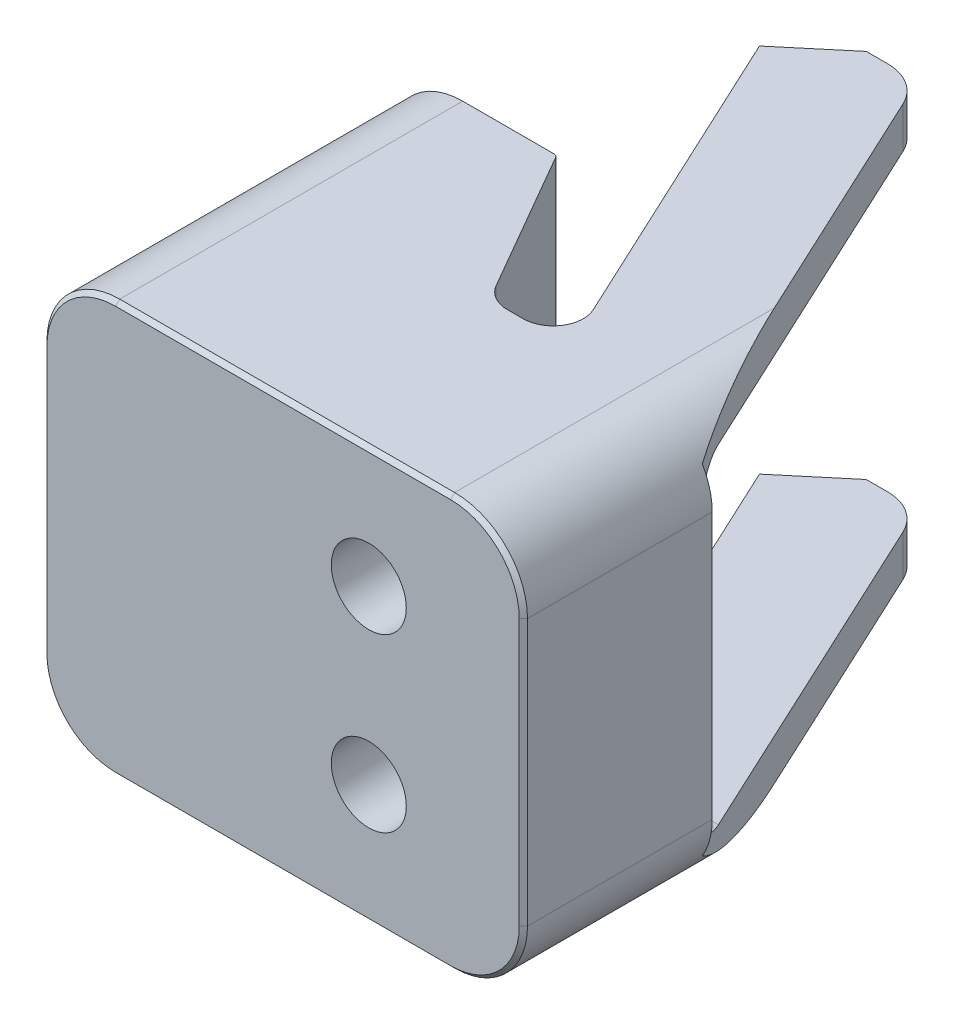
SolidWorks part; units mm, degrees
ref_plane "Front Plane" through (0, 0, 0) normal (0, 0, 1) x (1, 0, 0)
ref_plane "Top Plane" through (0, 0, 0) normal (0, 1, 0) x (1, 0, 0)
ref_plane "Right Plane" through (0, 0, 0) normal (1, 0, 0) x (0, 0, -1)
ref_plane "Plane1" through (0, -15.875, 0) normal (0, 1, 0) x (-1, 0, 0)
sketch "Sketch1" plane through (0, 0, 0) normal (1, 0, 0) x (0, 0, -1)
  line L0 (0, 41.896) -> (0, -41.896) construction
  line L1 (0, 38.0873) -> (109.474, 38.0873)
  line L2 (109.474, 38.0873) -> (109.474, -38.0873)
  line L3 (109.474, -38.0873) -> (0, -38.0873)
  line L4 (0, -38.0873) -> (0, 38.0873)
  line L6 (58.8563, 0) -> (-58.8563, 0) construction
  dimension "D1" = 76.1746
  dimension "D2" = 109.474
  dimension "D3" = 38.0873
extrude "Extrude1" add sketch "Sketch1" against normal blind 88.8746
sketch "Sketch2" plane through (0, 0, 0) normal (0, 1, 0) x (1, 0, 0)
  line L0 (0, 34.925) -> (-1.8244, 34.925)
  line L1 (0, 0) -> (0, 109.474) construction
  line L2 (-1.8244, 34.925) -> (-49.2012, 136.525)
  line L3 (-49.2012, 136.525) -> (0, 136.525)
  line L4 (0, -41.896) -> (0, 41.896) construction
  line L5 (0, 136.525) -> (0, 34.925)
  line L6 (-88.8746, 0) -> (0, 0) construction
  line L8 (-12.6746, 10.56) -> (-12.6746, -9.1288) construction
  line L9 (-88.8746, 0) -> (-88.8746, 109.474) construction
  line L10 (-1.8244, 34.925) -> (19.3938, -10.5776) construction
  circle A0 centre (-2.1145, 10.5601) radius 10.5601 construction
  dimension "D5" = 21.1201
  dimension "D6" = 76.2
  dimension "D2" = 34.925
  dimension "D3" = 25
  dimension "D4" = 101.6
extrude "Cut-Extrude1" cut sketch "Sketch2" against normal mid plane 127
fillet "Fillet2" radius 13.462 4 edges at (-88.8746, 38.0873, -54.737) (-88.8746, -38.0873, -54.737) (0, 38.0873, -17.4625) (0, -38.0873, -17.4625)
chamfer "Chamfer1" distance 0.762 angle 45 8 edges at (-84.9317, -34.1444, 0) (-44.4373, -38.0873, 0) (-3.9429, -34.1444, 0) (0, 0, 0) (-3.9429, 34.1444, 0) (-88.8746, 0, 0) (-84.9317, 34.1444, 0) (-44.4373, 38.0873, 0)
sketch "Sketch3" plane through (0, 0, 0) normal (0, 1, 0) x (1, 0, 0)
  line L0 (-26.2349, 34.925) -> (-56.7949, 100.4612)
  line L1 (-26.2349, 34.925) -> (-41.1433, 34.925)
  line L2 (-41.1433, 34.925) -> (-58.0371, 64.1858)
  line L3 (-107.0115, 113.933) -> (-40.7397, 113.933)
  line L4 (-41.896, 0) -> (41.896, 0) construction
  line L5 (-13.462, 59.8819) -> (-36.5872, 109.474) construction
  line L6 (0, -41.896) -> (0, 41.896) construction
  line L7 (-56.7949, 100.4612) -> (-40.7397, 113.933)
  line L9 (-75.4126, 109.474) -> (-36.5872, 109.474) construction
  line L10 (-58.0371, 64.1858) -> (-107.0115, 64.1858)
  line L11 (-107.0115, 64.1858) -> (-107.0115, 113.933)
  line L13 (-41.1433, 34.925) -> (-19.1455, -3.1763) construction
  line L14 (-20.8634, 22.4288) -> (-8.3743, 32.9083) construction
  line L15 (-75.4126, 0) -> (-13.462, 0) construction
  line L16 (-38.0746, 6.2573) -> (-38.0746, -1.9107) construction
  line L17 (-88.8746, 109.474) -> (-88.8746, 0.762) construction
  circle A0 centre (-31.8173, 6.2573) radius 6.2573 construction
  circle A1 centre (-12.7, 12.7) radius 12.7 construction
  dimension "D11" = 12.5146
  dimension "D3" = 34.925
  dimension "D12" = 25.4
  dimension "D2" = 22.1234
  dimension "D4" = 30
  dimension "D5" = 64.1858
  dimension "D6" = 40
  dimension "D7" = 50.8
  dimension "D8" = 4.459
  dimension "D9" = 82.8726
  dimension "D10" = 60
  dimension "D13" = 66.2717
extrude "Cut-Extrude2" cut sketch "Sketch3" against normal mid plane 127
fillet "Fillet3" radius 8.636 1 edges at (-36.5872, 0, -109.474)
fillet "Fillet5" radius 5.5626 1 edges at (-26.2349, 0, -34.925)
fillet "Fillet6" radius 5.5626 1 edges at (-41.1433, 0, -34.925)
sketch "Sketch4" plane through (0, 0, 0) normal (1, 0, 0) x (0, 0, -1)
  line L0 (58.8563, 0) -> (-58.8563, 0) construction
  line L1 (136.525, -30.48) -> (34.925, -30.48)
  line L2 (136.525, -30.48) -> (136.525, 30.48)
  line L3 (136.525, 30.48) -> (34.925, 30.48)
  line L4 (34.925, -30.48) -> (34.925, 30.48)
  line L5 (34.925, -24.6253) -> (34.925, 24.6253) construction
  dimension "D1" = 60.96
  dimension "D2" = 30.48
  dimension "D3" = 101.6
extrude "Cut-Extrude3" cut sketch "Sketch4" against normal blind 36.83
fillet "Fillet7" radius 5.5626 2 edges at (-18.3954, -30.48, -34.925) (-18.3954, 30.48, -34.925)
sketch "Sketch5" plane through (0, 30.48, 0) normal (0, -1, 0) x (1, 0, 0)
  line L1 (-15.6996, -54.3062) -> (-47.6386, -54.3062)
  line L2 (-15.6996, -54.3062) -> (-15.6996, -126.2865)
  line L3 (-15.6996, -126.2865) -> (-82.647, -126.2865)
  line L5 (-82.647, -126.2865) -> (-47.6386, -54.3062)
extrude "Cut-Extrude4" cut sketch "Sketch5" along normal up to surface (60.96 mm away)
sketch "Sketch6" plane through (0, -15.875, 0) normal (0, 1, 0) x (-1, 0, 0)
  line L0 (28.5877, -9.5852) -> (28.5877, 20.0987) construction
  line L2 (28.5877, -42.2666) -> (18.669, -42.2666)
  line L4 (18.669, -42.2666) -> (18.669, -21.463)
  line L5 (18.669, -21.463) -> (21.6535, -21.463)
  line L6 (21.6535, -21.463) -> (21.6535, 33.9334)
  line L8 (21.6535, 33.9334) -> (28.5877, 33.9334)
  line L9 (28.5877, 33.9334) -> (28.5877, -42.2666)
  line L12 (44.4373, 43.0254) -> (44.4373, -61.5447) construction
  line L13 (88.8746, -64.1858) -> (88.8746, -0.762) construction
  line L14 (34.9664, -34.925) -> (1.8244, -34.925) construction
  dimension "D1" = 44.4373
  dimension "D2" = 13.8684
  dimension "D3" = 19.8374
  dimension "D4" = 13.462
  dimension "D5" = 15.8496
  dimension "D6" = 76.2
  dimension "D7" = 7.3416
revolve "Cut-Revolve1" cut sketch "Sketch6" angle 360 about L0
mirror "Mirror1" about plane through (0, 0, 0) normal (0, 1, 0) of "Cut-Revolve1"
fillet "Fillet8" radius 0.762 1 edges at (-58.0371, 0, -64.1858)
